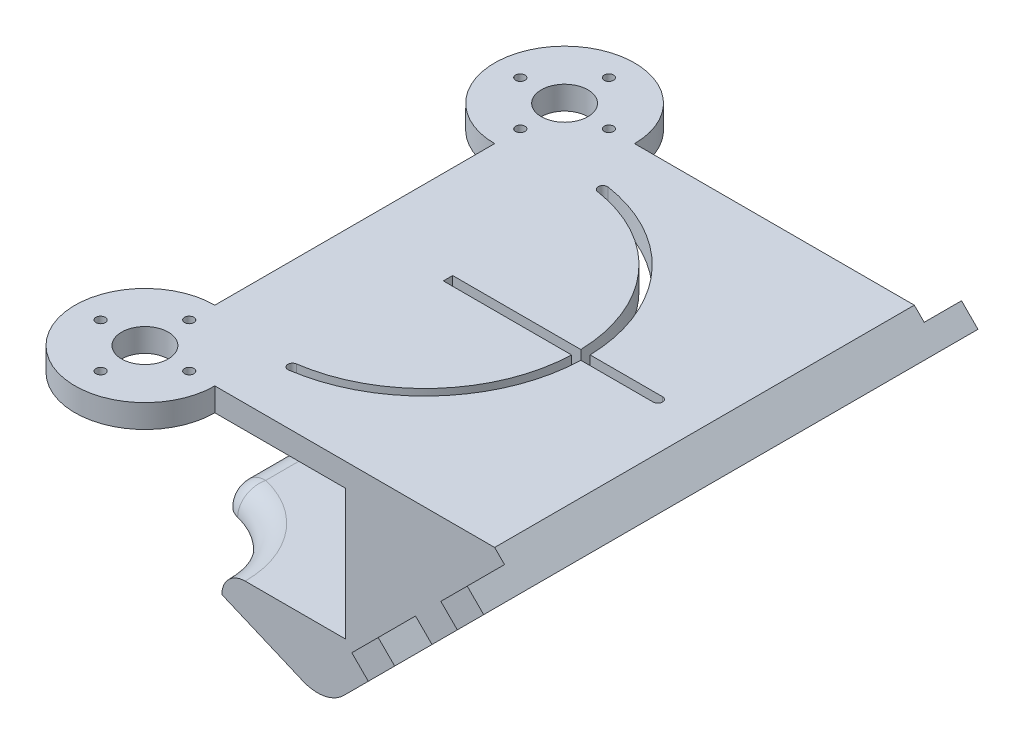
SolidWorks part; units mm, degrees
ref_plane "前视基准面" through (0, 0, 0) normal (0, 0, 1) x (1, 0, 0)
ref_plane "上视基准面" through (0, 0, 0) normal (0, 1, 0) x (1, 0, 0)
ref_plane "右视基准面" through (0, 0, 0) normal (1, 0, 0) x (0, 0, -1)
sketch "草图1" plane through (0, 0, 0) normal (1, 0, 0) x (0, 0, -1)
  line L1 (-80.1825, 41.6792) -> (9.8175, 41.6792)
  line L2 (-80.1825, 41.6792) -> (-80.1825, 3.6792)
  line L3 (-80.1825, 3.6792) -> (9.8175, 3.6792)
  line L4 (9.8175, 41.6792) -> (9.8175, 3.6792)
  line L5 (-75.1825, 36.6792) -> (4.8175, 36.6792)
  line L6 (-75.1825, 36.6792) -> (-75.1825, 8.6792)
  line L7 (-75.1825, 8.6792) -> (4.8175, 8.6792)
  line L8 (4.8175, 36.6792) -> (4.8175, 8.6792)
  dimension "D1" = 80
  dimension "D2" = 28
  dimension "D3" = 5
  dimension "D4" = 5
  dimension "D5" = 5
  dimension "D6" = 5
extrude "凸台-拉伸1" add sketch "草图1" along normal blind 75
sketch "草图3" plane through (0, 0, 80.1825) normal (0, 0, 1) x (1, 0, 0)
  line L0 (75, 41.6792) -> (75, 3.6792)
  line L1 (75, 3.6792) -> (37, 3.6792)
  line L2 (75, 3.6792) -> (0, 3.6792) construction
  line L3 (37, 3.6792) -> (75, 41.6792)
  dimension "D1" = 45
extrude "切除-拉伸1" cut sketch "草图3" against normal up to surface (90 mm away)
sketch "草图7" plane through (16.6604, -16.6604, 0) normal (0.7071, -0.7071, 0) x (0, 0, -1)
  line L1 (-80.1825, 82.5047) -> (9.8175, 82.5047)
  line L2 (-80.1825, 82.5047) -> (-80.1825, 28.7646)
  line L3 (-80.1825, 28.7646) -> (9.8175, 28.7646)
  line L4 (9.8175, 82.5047) -> (9.8175, 28.7646)
  line L5 (-75.1825, 75.4336) -> (4.8175, 75.4336)
  line L6 (-75.1825, 75.4336) -> (-75.1825, 35.8356)
  line L7 (-75.1825, 35.8356) -> (4.8175, 35.8356)
  line L8 (4.8175, 75.4336) -> (4.8175, 35.8356)
extrude "凸台-拉伸3" add sketch "草图7" along normal blind 8
sketch "草图9" plane through (0, 3.6792, 0) normal (0, -1, 0) x (1, 0, 0)
  circle A0 centre (0, -9.8175) radius 16.5
  circle A1 centre (0, 80.1825) radius 16.5
  dimension "D1" = 33
  dimension "D2" = 33
extrude "切除-拉伸3" cut sketch "草图9" against normal up to surface (33 mm away)
sketch "草图10" plane through (0, 0, -9.8175) normal (0, 0, -1) x (-1, 0, 0)
  line L0 (0, 36.6792) -> (-16.5, 36.6792) construction
  line L1 (0, 36.6792) -> (-43, 36.6792)
  line L2 (0, 36.6792) -> (0, 8.6792)
  line L3 (0, 8.6792) -> (-43, 8.6792)
  line L4 (-43, 36.6792) -> (-43, 8.6792)
  dimension "D1" = 43
  dimension "D2" = 28
extrude "切除-拉伸4" cut sketch "草图10" against normal up to surface (90 mm away)
sketch "草图11" plane through (0, 41.6792, 0) normal (0, 1, 0) x (1, 0, 0)
  circle A0 centre (0, -80.1825) radius 15
  circle A1 centre (0, 9.8175) radius 15
  dimension "D1" = 30
  dimension "D2" = 30
extrude "凸台-拉伸4" add sketch "草图11" against normal up to surface (5 mm away)
fillet "圆角1" radius 5 1 edges at (70, 36.6792, 35.1825)
fillet "圆角2" radius 5 1 edges at (42, 8.6792, 35.1825)
fillet "圆角3" radius 5 1 edges at (0, 8.6792, 35.1825)
sketch "草图13" plane through (0, 36.6792, 0) normal (0, -1, 0) x (1, 0, 0)
  circle A0 centre (0, -9.8175) radius 5
  circle A1 centre (0, 80.1825) radius 5
  circle A2 centre (-9.5, -9.8175) radius 1
  circle A3 centre (0, -0.3175) radius 1
  circle A4 centre (9.5, -9.8175) radius 1
  circle A5 centre (0, -19.3175) radius 1
  circle A6 centre (-9.5, 80.1825) radius 1
  circle A7 centre (0, 89.6825) radius 1
  circle A8 centre (9.5, 80.1825) radius 1
  circle A9 centre (0, 70.6825) radius 1
  point P17 (0, -9.8175)
  point P26 (0, 80.1825)
  dimension "D1" = 10
  dimension "D2" = 10
  dimension "D3" = 2
  dimension "D6" = 2
  dimension "D4" = 9.5
  dimension "D7" = 9.5
  dimension "D5" = 4
  dimension "D8" = 4
extrude "切除-拉伸5" cut sketch "草图13" against normal up to next
sketch "草图14" plane through (22.3172, -22.3172, 0) normal (0.7071, -0.7071, 0) x (0, 0, -1)
  line L0 (-80.1825, 82.5047) -> (-88.1825, 82.5047)
  line L1 (-88.1825, 82.5047) -> (-88.1825, 74.5047)
  line L2 (-88.1825, 74.5047) -> (-80.1825, 74.5047)
  line L3 (9.8175, 82.5047) -> (17.8175, 82.5047)
  line L4 (17.8175, 82.5047) -> (17.8175, 74.5047)
  line L5 (17.8175, 74.5047) -> (9.8175, 74.5047)
  line L6 (9.8175, 74.5047) -> (9.8175, 82.5047)
  line L9 (9.8175, 28.7646) -> (9.8175, 82.5047) construction
  line L10 (9.8175, 47.5047) -> (17.8175, 47.5047)
  line L11 (9.8175, 47.5047) -> (9.8175, 55.5047)
  line L12 (9.8175, 55.5047) -> (17.8175, 55.5047)
  line L13 (17.8175, 47.5047) -> (17.8175, 55.5047)
  line L14 (9.8175, 82.5047) -> (-80.1825, 82.5047) construction
  line L15 (-80.1825, 82.5047) -> (-80.1825, 28.7646) construction
  line L17 (-80.1825, 55.5047) -> (-88.1825, 55.5047)
  line L18 (-80.1825, 55.5047) -> (-80.1825, 47.5047)
  line L19 (-80.1825, 47.5047) -> (-88.1825, 47.5047)
  line L20 (-88.1825, 55.5047) -> (-88.1825, 47.5047)
  circle A0 centre (-84.1825, 78.5047) radius 1
  circle A1 centre (13.8175, 78.5047) radius 1
  circle A2 centre (13.8175, 51.5047) radius 1
  circle A3 centre (-84.1825, 51.5047) radius 1
  dimension "D5" = 4
  dimension "D6" = 4
  dimension "D11" = 2
  dimension "D12" = 4
  dimension "D13" = 2
  dimension "D14" = 8
  dimension "D15" = 8
  dimension "D16" = 2
  dimension "D20" = 2
  dimension "D21" = 4
  dimension "D22" = 4
  dimension "D24" = 4
  dimension "D3" = 8
  dimension "D4" = 8
  dimension "D7" = 35
  dimension "D8" = 8
  dimension "D9" = 8
  dimension "D10" = 4
  dimension "D17" = 35
  dimension "D18" = 8
  dimension "D19" = 8
  dimension "D23" = 4
extrude "凸台-拉伸5" add sketch "草图14" against normal blind 5 contours L1 L2 L0 A0 M6 | L17 L20 L19 A3 M6 | L10 L13 L12 A2 M8 | L5 L4 L3 A1 M8
fillet "圆角4" radius 4 1 edges at (75.6569, 31.0224, 35.1825)
sketch "草图15" plane through (0, 0, -9.8175) normal (0, 0, -1) x (-1, 0, 0)
  line L0 (-16.5, 3.6792) -> (-33.878, -3.6865)
  line L1 (-16.5, 3.6792) -> (-37, 3.6792)
  line L2 (-37, 3.6792) -> (-42.6569, -1.9776)
  arc A0 (-42.6569, -1.9776) -> (-33.878, -3.6865) centre (-37, 3.6792) ccw
extrude "凸台-拉伸6" add sketch "草图15" against normal up to surface (90 mm away)
fillet "圆角5" radius 5 7 edges at (1.0938, 6.8004, 6.6462) (1.9411, 7.6344, 63.7971) (13.3182, 8.6792, -0.0771) (13.3182, 8.6792, 70.4421) (43, 22.6792, 75.1825) (43, 22.6792, -4.8175) (0, 36.6792, 35.1825)
sketch "草图16" plane through (0, 41.6792, 0) normal (0, 1, 0) x (1, 0, 0)
  line L0 (65, -35.1825) -> (15, -35.1825) construction
  line L1 (65, -36.1825) -> (15, -36.1825)
  line L2 (65, -34.1825) -> (15, -34.1825)
  line L3 (75, -80.1825) -> (15, -80.1825) construction
  line L4 (75, 9.8175) -> (75, -80.1825) construction
  line L7 (20, -34.1825) -> (20, -36.1825)
  arc A0 (65, -36.1825) -> (65, -34.1825) centre (65, -35.1825) ccw
  arc A1 (15, -34.1825) -> (15, -36.1825) centre (15, -35.1825) ccw
  arc A2 (19.9483, -69.3258) -> (20.246, -1.0837) centre (15, -35.1825) ccw
  arc A3 (19.6614, -67.3465) -> (19.9419, -3.0604) centre (15, -35.1825) ccw
  arc A4 (20.246, -1.0837) -> (19.9419, -3.0604) centre (20.0939, -2.072) ccw
  arc A5 (19.6614, -67.3465) -> (19.9483, -69.3258) centre (19.8049, -68.3361) ccw
  point P2 (40, -35.1825)
  dimension "D4" = 1
  dimension "D5" = 65
  dimension "D6" = 69
  dimension "D7" = 2
  dimension "D1" = 45
  dimension "D2" = 10
  dimension "D3" = 50
extrude "切除-拉伸6" cut sketch "草图16" against normal up to next
ref_plane "基准面1" through (0, -4.3208, 0) normal (0, -1, 0) x (-1, 0, 0)
sketch "草图17" plane through (0, -4.3208, 0) normal (0, -1, 0) x (-1, 0, 0)
  line L0 (-18.6892, -35.1825) -> (-43.6892, -35.1825) construction
  line L1 (-18.6892, -37.1825) -> (-43.6892, -37.1825)
  line L2 (-18.6892, -33.1825) -> (-43.6892, -33.1825)
  line L3 (-16.5, -80.1825) -> (-33.878, -80.1825) construction
  arc A0 (-18.6892, -37.1825) -> (-18.6892, -33.1825) centre (-18.6892, -35.1825) ccw
  arc A1 (-43.6892, -33.1825) -> (-43.6892, -37.1825) centre (-43.6892, -35.1825) ccw
  point P2 (-31.1892, -35.1825)
  dimension "D2" = 2
  dimension "D1" = 25
  dimension "D3" = 45
extrude "切除-拉伸7" cut sketch "草图17" against normal blind 8
sketch "草图18" plane through (0, 3.6792, 0) normal (0, -1, 0) x (1, 0, 0)
  line L0 (21.6892, 35.2349) -> (41.6892, 35.2349) construction
  line L1 (21.6892, 36.0209) -> (41.6892, 36.0209)
  line L2 (21.6892, 34.4489) -> (41.6892, 34.4489)
  arc A0 (21.6892, 36.0209) -> (21.6892, 34.4489) centre (21.6892, 35.2349) ccw
  arc A1 (41.6892, 34.4489) -> (41.6892, 36.0209) centre (41.6892, 35.2349) ccw
  arc A2 (43.6892, 33.1825) -> (43.6892, 37.1825) centre (43.6892, 35.1825) ccw construction
  point P2 (31.6892, 35.2349)
  dimension "D2" = 0.786
  dimension "D1" = 20
  dimension "D3" = 2
extrude "切除-拉伸8" cut sketch "草图18" against normal up to next
